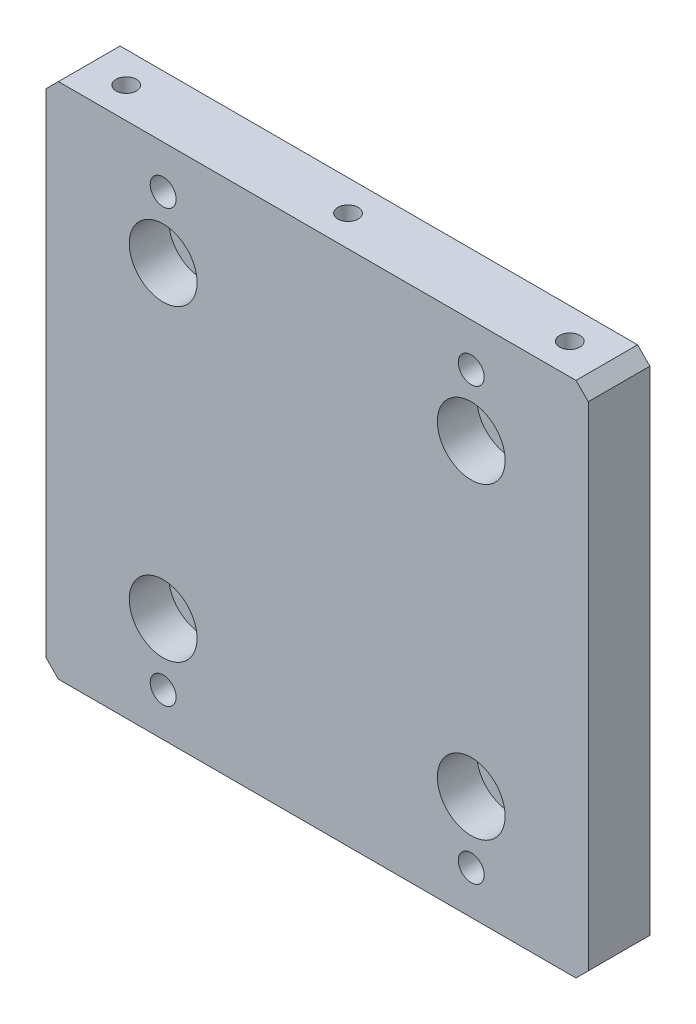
SolidWorks part; units mm, degrees
ref_plane "Plan1" through (0, 0, 0) normal (0, 0, 1) x (1, 0, 0)
ref_plane "Plan2" through (0, 0, 0) normal (0, 1, 0) x (1, 0, 0)
ref_plane "Plan3" through (0, 0, 0) normal (1, 0, 0) x (0, 0, -1)
sketch "Esquisse1" plane through (0, 0, 0) normal (0, 0, 1) x (1, 0, 0)
  line L0 (0, 45.1227) -> (0, 0) construction
  line L1 (0, 0) -> (54.6468, 0) construction
  line L3 (-44, 42) -> (44, 42)
  line L4 (-44, 42) -> (-44, -42)
  line L5 (-44, -42) -> (44, -42)
  line L6 (44, 42) -> (44, -42)
  dimension "D1" = 84
  dimension "D2" = 44
  dimension "D3" = 44
extrude "Boss.-Extru.1" add sketch "Esquisse1" along normal blind 10
hole_wizard "Chambrage pour vis à tête hexagonale M61" positions "Esquisse2" profile "Esquisse4" counterbore size "M6" standard "ISO"
sketch "Esquisse2" plane through (0, 0, 10) normal (0, 0, 1) x (1, 0, 0)
  line L0 (0, 22.792) -> (0, 0) construction
  line L1 (0, 0) -> (22.9213, 0) construction
  point P7 (25, 25)
  point P10 (25, -25)
  point P15 (-25, -25)
  point P16 (-25, 25)
  dimension "D1" = 50
  dimension "D2" = 50
sketch "Esquisse4" plane through (-25, 25, 10) normal (1, 0, 0) x (0, -1, 0)
  line L0 (0, 0) -> (0, 10)
  line L1 (0, 10) -> (3.2, 10)
  line L3 (3.2, 10) -> (3.2, 6.4)
  line L4 (3.2, 6.4) -> (5.5, 6.4)
  line L5 (5.5, 6.4) -> (5.5, 0)
  line L7 (5.5, 0) -> (0, 0)
  line L11 (0, -6.35) -> (0, 107.95) construction
  dimension "Diamètre du perçage jusqu'au prochain" = 6.4
  dimension "Profondeur du perçage jusqu'au prochain" = 10
  dimension "Diamètre du chambrage" = 11
  dimension "Profondeur du chambrage" = 6.4
hole_wizard "Trou taraudé M51" positions "Esquisse5" profile "Esquisse6" tap size "M5" standard "ISO"
sketch "Esquisse5" plane through (0, 0, 10) normal (0, 0, 1) x (1, 0, 0)
  line L0 (0, 0) -> (44, 0) construction
  line L1 (44, -42) -> (44, 42) construction
  point P0 (-25, 35)
  point P2 (25, 35)
  point P11 (25, -35)
  point P12 (-25, -35)
  dimension "D1" = 50
  dimension "D2" = 70
  dimension "D3" = 25
sketch "Esquisse6" plane through (-25, 35, 10) normal (1, 0, 0) x (0, -1, 0)
  line L0 (0, 0) -> (0, 10)
  line L1 (0, 10) -> (2.1, 10)
  line L2 (2.1, 10) -> (2.1, 0)
  line L5 (2.1, 0) -> (0, 0)
  line L11 (0, -6.35) -> (0, 107.95) construction
  dimension "Diamètre du trou pour taraudage jusqu'au prochain" = 4.2
  dimension "Profondeur du trou pour taraudage jusqu'au prochain" = 10
chamfer "Chanfrein1" distance 2 angle 45 4 edges at (44, -42, 5) (44, 42, 5) (-44, -42, 5) (-44, 42, 5)
hole_wizard "Trou taraudé M4x0.71" positions "Esquisse7" profile "Esquisse8" tap size "M4x0.7" standard "Ansi Metric"
sketch "Esquisse7" plane through (0, 42, 0) normal (0, 1, 0) x (1, 0, 0)
  line L0 (44, -5) -> (36, -5) construction
  line L1 (44, 0) -> (44, -10) construction
  line L2 (36, -5) -> (0, -5) construction
  line L3 (0, -5) -> (-36, -5) construction
  line L5 (0, -5) -> (0, -10) construction
  line L6 (42, -10) -> (-42, -10) construction
  point P0 (36, -5)
  point P2 (0, -5)
  point P4 (-36, -5)
  dimension "D1" = 36
sketch "Esquisse8" plane through (36, 42, 5) normal (1, 0, 0) x (0, 0, 1)
  line L0 (0, 0) -> (0, 14.4914)
  line L1 (0, 14.4914) -> (1.65, 13.5)
  line L2 (1.65, 13.5) -> (1.65, 0)
  line L5 (1.65, 0) -> (0, 0)
  line L10 (0, 14.4914) -> (-1.65, 13.5) construction
  line L11 (0, -6.35) -> (0, 107.95) construction
  dimension "Diamètre du trou pour taraudage" = 3.3
  dimension "Profondeur du trou pour taraudage" = 13.5
  dimension "Angle de pointe" = 118
